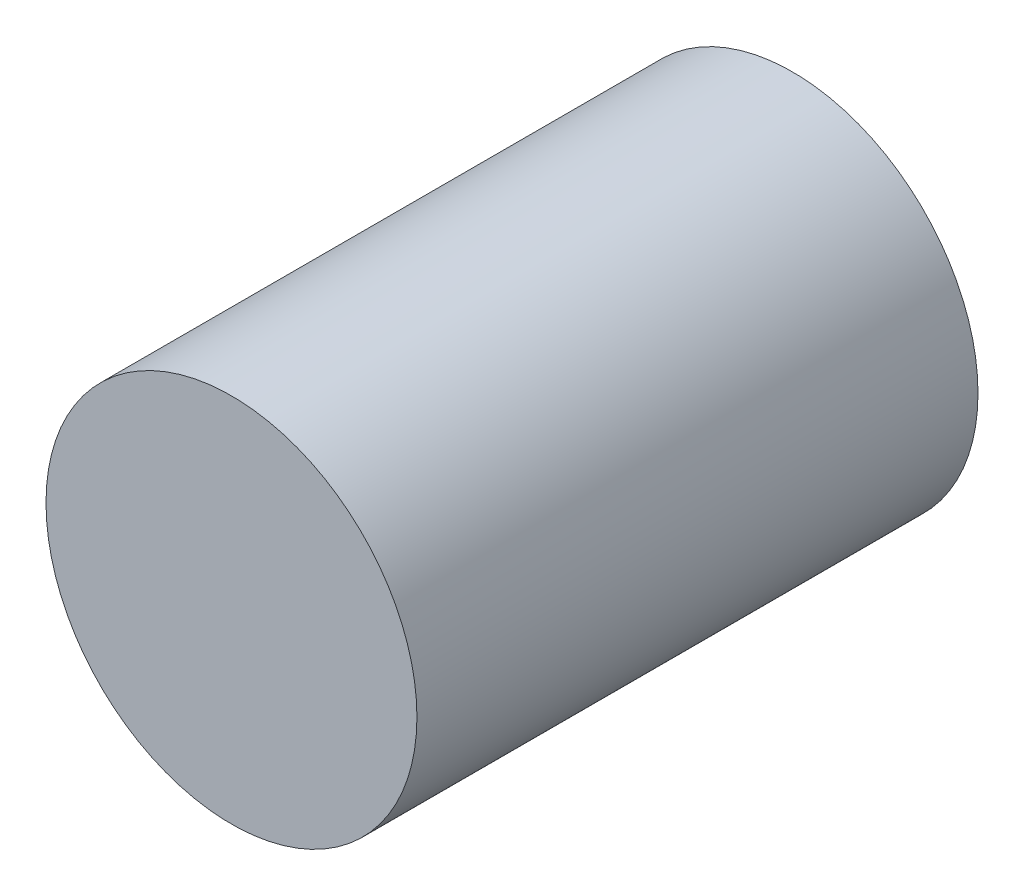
SolidWorks part; units mm, degrees
ref_plane "正面" through (0, 0, 0) normal (0, 0, 1) x (1, 0, 0)
ref_plane "平面" through (0, 0, 0) normal (0, 1, 0) x (1, 0, 0)
ref_plane "右側面" through (0, 0, 0) normal (1, 0, 0) x (0, 0, -1)
sketch "ｽｹｯﾁ1" plane through (0, 0, 0) normal (0, 0, 1) x (1, 0, 0)
  circle A0 centre (47.9911, -2.8154) radius 4 construction
  circle A1 centre (47.9911, -2.8154) radius 4
extrude "ﾎﾞｽ - 押し出し1" add sketch "ｽｹｯﾁ1" along normal up to vertex (12.1 mm away)
